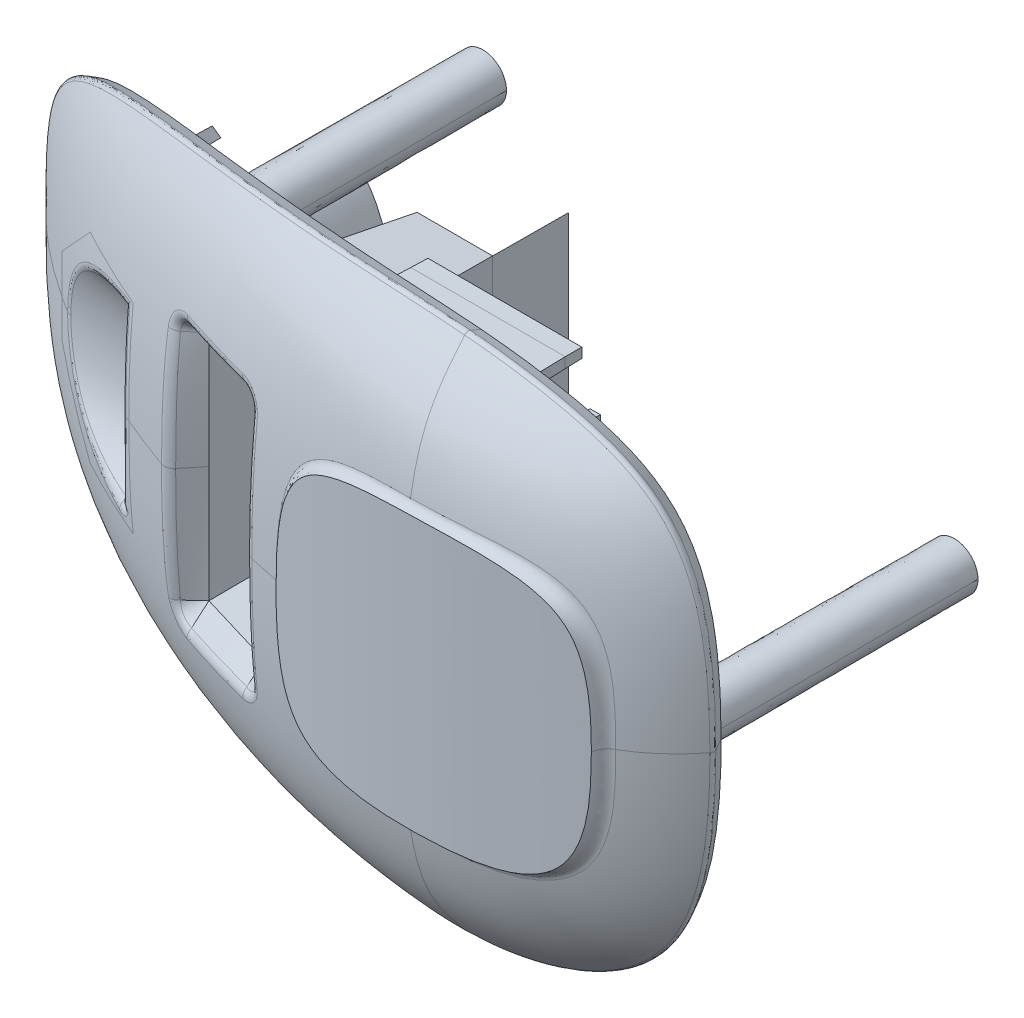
SolidWorks part; units mm, degrees
ref_plane "Plan de face" through (0, 0, 0) normal (0, 0, 1) x (1, 0, 0)
ref_plane "Plan de dessus" through (0, 0, 0) normal (0, 1, 0) x (1, 0, 0)
ref_plane "Plan de droite" through (0, 0, 0) normal (1, 0, 0) x (0, 0, -1)
imported_body "Importée3"
fillet "Congé1" radius 0.9935
fillet "Congé variable1" radius 1.7911
chamfer "Chanfrein1" distance 1.3769 angle 40.717 1 edges
